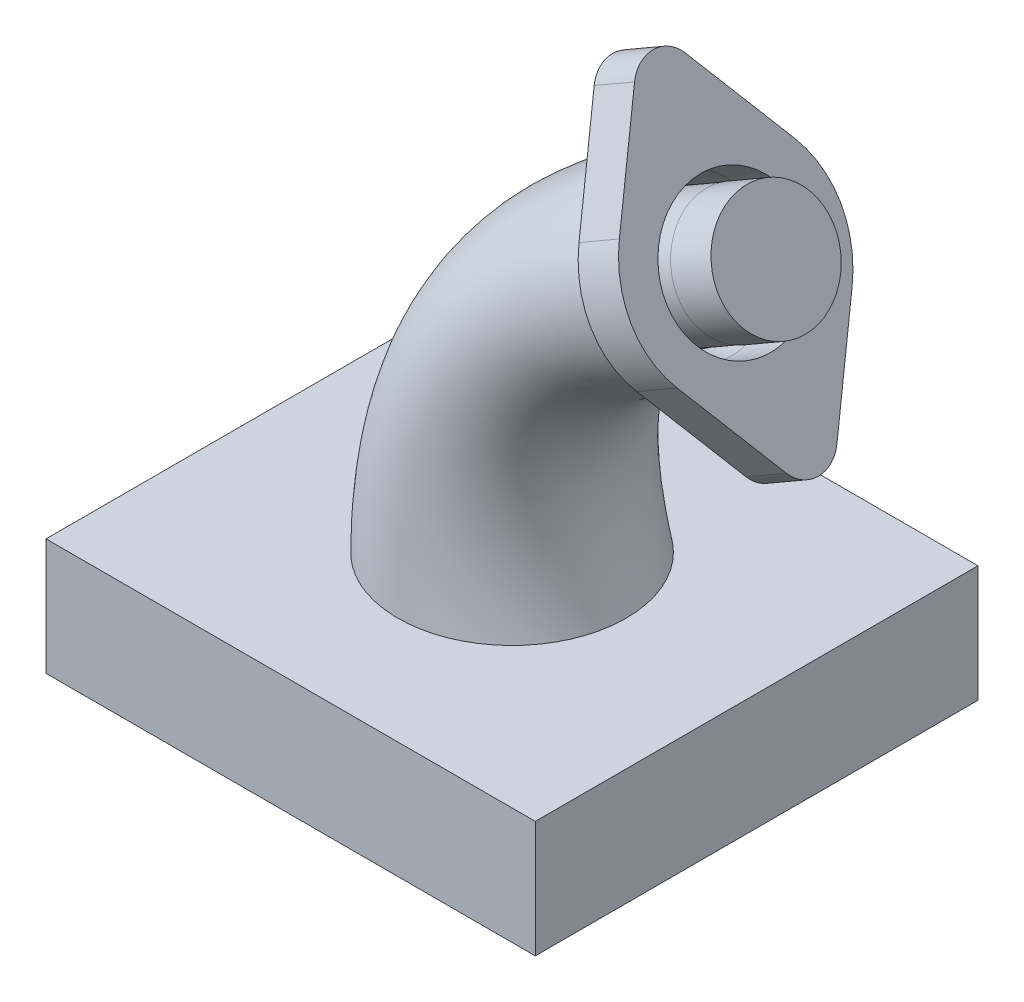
SolidWorks part; units mm, degrees
ref_plane "Ebene vorne" through (0, 0, 0) normal (0, 0, 1) x (1, 0, 0)
ref_plane "Ebene oben" through (0, 0, 0) normal (0, 1, 0) x (1, 0, 0)
ref_plane "Ebene rechts" through (0, 0, 0) normal (1, 0, 0) x (0, 0, -1)
sketch "Skizze12" plane through (0, 0, 0) normal (0, 0, 1) x (1, 0, 0)
  line L0 (178.2254, 804.7597) -> (994.2254, 804.7597) construction
  line L1 (0, 0) -> (54.7491, 0) construction
sketch "Skizze1" plane through (0, 0, 0) normal (0, 1, 0) x (1, 0, 0)
  line L1 (-52.5, -47.5) -> (52.5, -47.5)
  line L2 (-52.5, -47.5) -> (-52.5, 47.5)
  line L3 (-52.5, 47.5) -> (52.5, 47.5)
  line L4 (52.5, -47.5) -> (52.5, 47.5)
  line L5 (-52.5, -47.5) -> (52.5, 47.5) construction
  line L6 (-52.5, 47.5) -> (52.5, -47.5) construction
  point P0 (0, 0)
  dimension "D1" = 105
  dimension "D2" = 95
extrude "Grundplatte" add sketch "Skizze1" along normal blind 25
ref_plane "Ebene3" through (50.2003, 28.9832, 0) normal (0.866, 0.5, 0) x (0, 0, -1)
ref_plane "Ebene4" through (71.851, 41.4832, 0) normal (0.866, 0.5, 0) x (0, 0, -1)
sketch "Skizze3" plane through (0, 25, 0) normal (0, 1, 0) x (1, 0, 0)
  circle A0 centre (0, 0) radius 20
  circle A1 centre (0, 0) radius 24.5
  dimension "D1" = 40
  dimension "D2" = 4.5
sketch "Skizze7" plane through (66.2093, 51.2549, 0) normal (0.866, 0.5, 0) x (0, 0, 1)
  circle A0 centre (0, -53.7166) radius 15
  circle A1 centre (0, -53.7166) radius 19.5
  dimension "D1" = 30
  dimension "D2" = 39
  dimension "D3" = 65
sketch "Skizze6" plane through (0, 0, 0) normal (0, 0, 1) x (1, 0, 0)
  line L0 (24.5, 25) -> (-24.5, 25) construction
  line L3 (49.101, 80.8873) -> (29.601, 114.6623) construction
  spline S0 degree 2 poles (-24.5, 25) (-23.3511, 83.8346) (29.601, 114.6623) knots 0 0 0 1 1 1
loft "Ausformung18" add
sketch "Skizze9" plane through (0, 25, 0) normal (0, 1, 0) x (1, 0, 0)
  circle A0 centre (0, 0) radius 20
  dimension "D1" = 40
sketch "Skizze10" plane through (71.851, 41.4832, 0) normal (0.866, 0.5, 0) x (0, 0, -1)
  circle A0 centre (0, 65) radius 15
  dimension "D2" = 30
  dimension "D1" = 65
sketch "Skizze8" plane through (0, 0, 0) normal (0, 0, 1) x (1, 0, 0)
  line L0 (49.101, 80.8873) -> (29.601, 114.6623) construction
  line L1 (24.5, 25) -> (-24.5, 25) construction
  spline S0 degree 3 poles (29.851, 114.2293) (13.9752, 105.0634) (-15.8168, 80.4569) (-24, 42.7012) (-24, 25) knots 0 0 0 0 0.509834 1 1 1 1 construction
  spline S1 degree 1 poles (31.851, 110.7652) (-20, 25) knots 0 0 1 1 construction
  spline S2 degree 3 poles (31.851, 110.7652) (29.9445, 109.6645) (26.1914, 107.3871) (18.8105, 102.4225) (10.0444, 95.5061) (0.6646, 86.0717) (-7.1447, 75.5638) (-13.0266, 63.9025) (-17.1203, 51.2955) (-19.0997, 40.3694) (-19.874, 31.5602) (-20, 27.1906) (-20, 25) knots 0 0 0 0 0.0625 0.125 0.25 0.375 0.5 0.625 0.75 0.875 0.9375 1 1 1 1
  dimension "D1" = 4
loft "Schnitt-Ausformung1" cut profiles "Skizze9", "Skizze10"
sketch "Skizze5" plane through (66.2093, 51.2549, 0) normal (0.866, 0.5, 0) x (0, 0, 1)
  line L0 (5.4212, -21.1304) -> (18.7656, -41.3028)
  line L1 (-5.4212, -21.1304) -> (-18.7656, -41.3028)
  line L2 (0, -53.7166) -> (0, -44.8019) construction
  line L3 (0, -53.7166) -> (8.7301, -53.7166) construction
  line L4 (-5.4212, -86.3028) -> (-18.7656, -66.1304)
  line L5 (0, -53.7603) -> (0, 76.327) construction
  line L6 (5.4212, -86.3028) -> (18.7656, -66.1304)
  line L7 (-9.9391, -89.2166) -> (-19.98, -89.2166) construction
  line L8 (0, 15.8827) -> (0, -111.5091) construction
  line L9 (47.5, 15.8827) -> (-47.5, 15.8827) construction
  arc A0 (-18.7656, -41.3028) -> (-18.7656, -66.1304) centre (0, -53.7166) ccw
  arc A1 (18.7656, -66.1304) -> (18.7656, -41.3028) centre (0, -53.7166) ccw
  arc A2 (5.4212, -21.1304) -> (-5.4212, -21.1304) centre (0, -24.7166) ccw
  arc A3 (5.4212, -86.3028) -> (-5.4212, -86.3028) centre (0, -82.7166) cw
  circle A4 centre (0, -53.7166) radius 15 construction
  circle A5 centre (0, -82.7166) radius 3.75 construction
  circle A7 centre (0, -24.7166) radius 3.75 construction
  dimension "D1" = 65
  dimension "D2" = 45
  dimension "D3" = 71
  dimension "D4" = 2.75
  dimension "D5" = 30
  dimension "D7" = 7.5
fillet "Verrundung3" [suppressed] radius 3
extrude "Aufsatz-Linear austragen2" add sketch "Skizze5" along normal blind 10
sketch "Skizze14" plane through (80.5112, 46.4832, 0) normal (0.866, 0.5, 0) x (0, 0, -1)
  arc A1 (18.7656, 52.5862) -> (18.7656, 77.4138) centre (0, 65) ccw construction
  circle A2 centre (0, 65) radius 12.5
  dimension "D1" = 25
extrude "Aufsatz-Linear austragen3" add sketch "Skizze14" along normal blind 10
sketch "Skizze15" plane through (0, 0, 0) normal (0, -1, 0) x (1, 0, 0)
  circle A0 centre (0, 0) radius 15
  dimension "D1" = 30
extrude "Aufsatz-Linear austragen4" add sketch "Skizze15" along normal blind 25
sketch "Skizze16" plane through (0, 25, 0) normal (0, 1, 0) x (1, 0, 0)
  spline S2 degree 3 number of poles 101 (0, -17.5) -> (0, -17.5)
  spline S3 degree 3 number of poles 101 (0, -17.5) -> (0, -17.5)
  dimension "D1" = 2.5
sketch "Skizze17" plane through (71.851, 41.4832, 0) normal (-0.866, -0.5, 0) x (0, 0, 1)
  spline S2 degree 3 number of poles 99 (0, 52.5) -> (0, 52.5)
  spline S3 degree 3 number of poles 99 (0, 52.5) -> (0, 52.5)
  dimension "D1" = 2.5
sketch "Skizze18" plane through (0, 0, 0) normal (0, 0, 1) x (1, 0, 0)
  line L0 (33.1441, 108.5255) -> (23.0578, 125.9953) construction
  line L1 (31.851, 110.7652) -> (46.851, 84.7844) construction
  line L2 (52.5, 25) -> (-52.5, 25) construction
  line L3 (20, 25) -> (-20, 25) construction
  spline S0 degree 3 poles (31.851, 110.7652) (20.9392, 104.4653) (5.2234, 92.8375) (-15.2792, 63.8924) (-20, 40.8684) (-20, 25) knots 0 0 0 0 0.359978 0.545163 1 1 1 1 construction
  spline S1 degree 1 poles (33.101, 108.6001) (-17.5, 25) knots 0 0 1 1 construction
  spline S2 degree 3 poles (33.101, 108.6001) (25.641, 104.2932) (14.8653, 96.8695) (2.7826, 84.684) (-4.8339, 74.31) (-10.6512, 62.891) (-14.6693, 50.6191) (-16.6154, 39.9916) (-17.3761, 31.4106) (-17.5, 27.1394) (-17.5, 25) knots 0 0 0 0 0.25 0.375 0.5 0.625 0.75 0.875 0.9375 1 1 1 1
  dimension "D1" = 2.5
loft "Ausformung19" add profiles "Skizze17", "Skizze16"
sketch "Skizze19" plane through (0, 0, 0) normal (0, 0, 1) x (1, 0, 0)
  line L0 (17.5, 25) -> (17.5, -29.1267)
  line L1 (17.5, 25) -> (20, 25)
  line L2 (20, 25) -> (20, -29.1267)
  line L3 (20, -29.1267) -> (17.5, -29.1267)
  line L4 (20, 25) -> (-20, 25) construction
  line L5 (0, 0) -> (0, 19.0273) construction
  line L8 (52.5, 25) -> (-52.5, 25) construction
revolve "Schnitt-Rotation1" cut sketch "Skizze19" angle 360 about L5
sketch "Skizze21" plane through (0, 0, 0) normal (0, 0, 1) x (1, 0, 0)
  line L0 (33.1441, 108.5255) -> (41.8043, 113.5255)
  line L1 (41.8043, 113.5255) -> (40.5438, 115.7087)
  line L2 (41.8043, 113.5255) -> (31.7181, 130.9953) construction
  line L3 (40.5438, 115.7087) -> (31.851, 110.7652)
  line L4 (33.1441, 108.5255) -> (23.0578, 125.9953) construction
  line L5 (31.851, 110.7652) -> (46.851, 84.7844) construction
  line L6 (31.851, 110.7652) -> (33.1441, 108.5255)
  line L7 (56.6715, 107.7748) -> (42.442, 99.5594) construction
  line L8 (62.9215, 96.9495) -> (50.4215, 118.6001) construction
revolve "Schnitt-Rotation2" cut sketch "Skizze21" angle 360 about L7
sketch "Skizze22" plane through (0, 0, 0) normal (0, -1, 0) x (1, 0, 0)
  circle A0 centre (0, 0) radius 20 construction
  circle A1 centre (0, 0) radius 20
  circle A3 centre (0, 0) radius 70
  dimension "D1" = 50
sketch "Skizze23" plane through (80.5112, 46.4832, 0) normal (0.866, 0.5, 0) x (0, 0, -1)
  circle A0 centre (0, 65) radius 14.9348 construction
  circle A1 centre (0, 65) radius 14.9348
  circle A3 centre (0, 65) radius 42.2491
sketch "Skizze24" plane through (0, 0, 0) normal (0, 0, 1) x (1, 0, 0)
  line L6 (69.1358, 66.186) -> (26.8866, 139.3636) construction
  line L7 (-70, 0) -> (70, 0) construction
  spline S0 degree 3 poles (26.8866, 139.3636) (-31.2721, 118.6989) (-61.7017, 57.124) (-70, 0) knots 0 0 0 0 1 1 1 1
  spline S1 degree 3 poles (40.5438, 115.7087) (30.9286, 109.037) (13.1188, 98.7593) (-4.9261, 78.5072) (-20.2503, 46.8715) (-19.1017, 19.2411) (-20, 0) knots 0 0 0 0 0.25223 0.438106 0.573683 1 1 1 1
